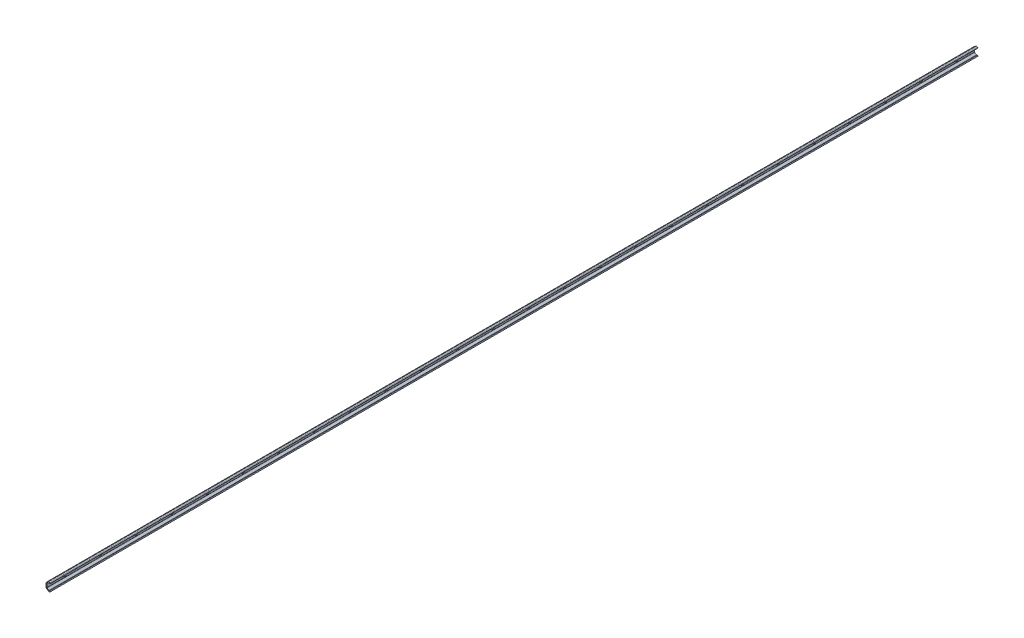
SolidWorks part; units mm, degrees
ref_plane "Front Plane" through (0, 0, 0) normal (0, 0, 1) x (1, 0, 0)
ref_plane "Top Plane" through (0, 0, 0) normal (0, 1, 0) x (1, 0, 0)
ref_plane "Right Plane" through (0, 0, 0) normal (1, 0, 0) x (0, 0, -1)
sketch "Sketch1" plane through (0, 0, 0) normal (0, 0, 1) x (1, 0, 0)
  line L0 (8.8528, 6.5211) -> (10, 8.1594)
  line L1 (10, 8.1594) -> (8.6321, 9.1172)
  line L2 (5.3679, 9.1172) -> (1.3827, 6.3267)
  line L3 (0, 3.8) -> (0, -3.8)
  line L4 (1.3827, -6.3267) -> (5.3679, -9.1172)
  line L5 (8.6321, -9.1172) -> (10, -8.1594)
  line L6 (10, -8.1594) -> (8.8528, -6.5211)
  line L7 (8.8528, -6.5211) -> (7.522, -7.453)
  line L8 (6.478, -7.453) -> (2.3691, -4.5758)
  line L9 (2, -3.8) -> (2, 3.8)
  line L10 (2.3691, 4.5758) -> (6.478, 7.453)
  line L12 (7.522, 7.453) -> (8.8528, 6.5211)
  arc A0 (8.6321, 9.1172) -> (5.3679, 9.1172) centre (7, 6.7863) ccw
  arc A1 (1.3827, 6.3267) -> (0, 3.8) centre (3.2464, 3.6652) ccw
  arc A2 (0, -3.8) -> (1.3827, -6.3267) centre (3, -3.8) ccw
  arc A3 (5.3679, -9.1172) -> (8.6321, -9.1172) centre (7, -6.7863) ccw
  arc A4 (7.522, -7.453) -> (6.478, -7.453) centre (7, -6.7075) cw
  arc A5 (2.3691, -4.5758) -> (2, -3.8) centre (2.8685, -3.8626) cw
  arc A6 (2, 3.8) -> (2.3691, 4.5758) centre (3, 3.8) cw
  arc A7 (6.478, 7.453) -> (7.522, 7.453) centre (7, 6.7075) cw
  dimension "D1" = 2.8455
  dimension "D2" = 3.2492
  dimension "D3" = 3
  dimension "D4" = 2.8455
  dimension "D5" = 0.91
  dimension "D6" = 0.8708
  dimension "D7" = 1
  dimension "D8" = 0.91
  dimension "D9" = 1.3827
  dimension "D10" = 1.3827
  dimension "D11" = 2
  dimension "D12" = 2.3691
  dimension "D13" = 2.8685
  dimension "D14" = 2.3691
  dimension "D15" = 3.2464
  dimension "D16" = 5.3679
  dimension "D17" = 3
  dimension "D18" = 5.3679
  dimension "D19" = 6.478
  dimension "D20" = 6.478
  dimension "D21" = 7
  dimension "D22" = 7.522
  dimension "D23" = 3.6652
  dimension "D24" = 3.8
  dimension "D31" = 8.8528
  dimension "D32" = 8.8528
  dimension "D33" = 10
  dimension "D34" = 10
extrude "Extrude1" add sketch "Sketch1" against normal blind 2080
sketch "Sketch2" plane through (2, 0, 0) normal (1, 0, 0) x (0, 0, -1)
  line L0 (38.75, 0) -> (41.25, 0) construction
  line L1 (38.75, 2.25) -> (41.25, 2.25)
  line L2 (38.75, -2.25) -> (41.25, -2.25)
  arc A0 (38.75, 2.25) -> (38.75, -2.25) centre (38.75, 0) ccw
  arc A1 (41.25, -2.25) -> (41.25, 2.25) centre (41.25, 0) ccw
  point P6 (40, 0)
  dimension "D1" = 2.5
  dimension "D2" = 4.5
  dimension "D3" = 40
extrude "Extrude2" cut sketch "Sketch2" against normal through all
pattern_linear "LPattern1" count 26 spacing 80 along (0, 0, -1) of "Extrude2"
